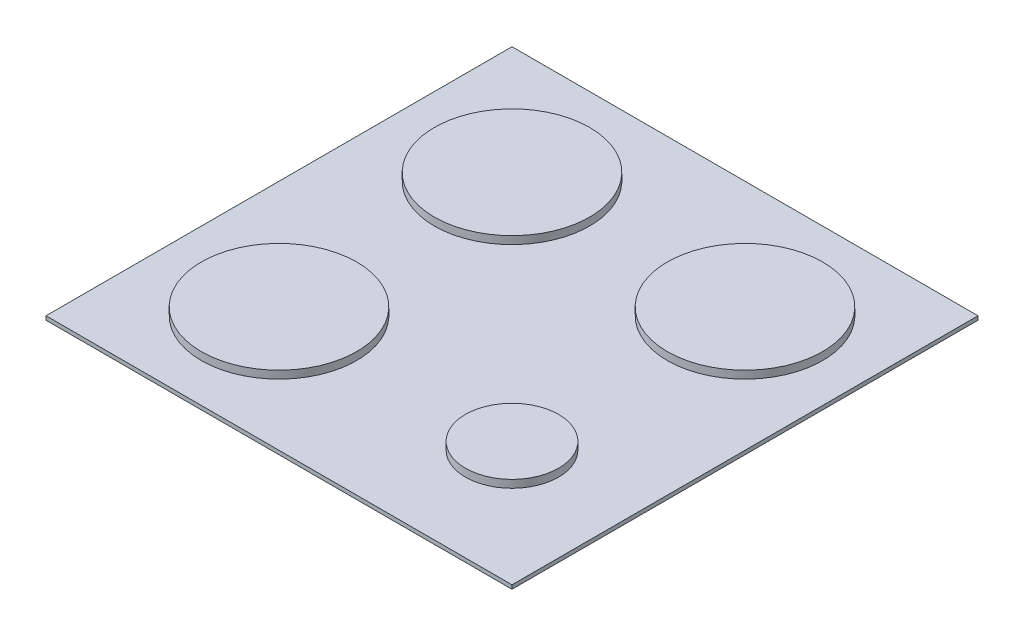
SolidWorks part; units mm, degrees
ref_plane "Plan de face" through (0, 0, 0) normal (0, 0, 1) x (1, 0, 0)
ref_plane "Plan de dessus" through (0, 0, 0) normal (0, 1, 0) x (1, 0, 0)
ref_plane "Plan de droite" through (0, 0, 0) normal (1, 0, 0) x (0, 0, -1)
sketch "Esquisse1" plane through (0, 0, 0) normal (0, 0, 1) x (1, 0, 0)
  line L1 (0, 0) -> (600, 0)
  line L2 (0, 0) -> (0, 5)
  line L3 (0, 5) -> (600, 5)
  line L4 (600, 0) -> (600, 5)
  dimension "D1" = 600
  dimension "D2" = 5
extrude "Boss.-Extru.1" add sketch "Esquisse1" along normal blind 600
sketch "Esquisse7" plane through (0, 5, 0) normal (0, 1, 0) x (1, 0, 0)
  line L0 (600, 0) -> (0, 0) construction
  line L1 (0, -600) -> (0, 0) construction
  line L2 (600, -600) -> (600, 0) construction
  line L3 (600, -600) -> (0, -600) construction
  circle A0 centre (150, -150) radius 100
  circle A1 centre (450, -150) radius 100
  circle A2 centre (150, -450) radius 100
  circle A3 centre (450, -450) radius 60
  point P8 (300, 0)
  dimension "D1" = 200
  dimension "D2" = 200
  dimension "D3" = 200
  dimension "D4" = 120
  dimension "D6" = 150
  dimension "D8" = 150
  dimension "D9" = 150
  dimension "D10" = 150
  dimension "D11" = 150
  dimension "D12" = 150
  dimension "D5" = 150
  dimension "D7" = 150
extrude "Boss.-Extru.5" add sketch "Esquisse7" along normal blind 10
